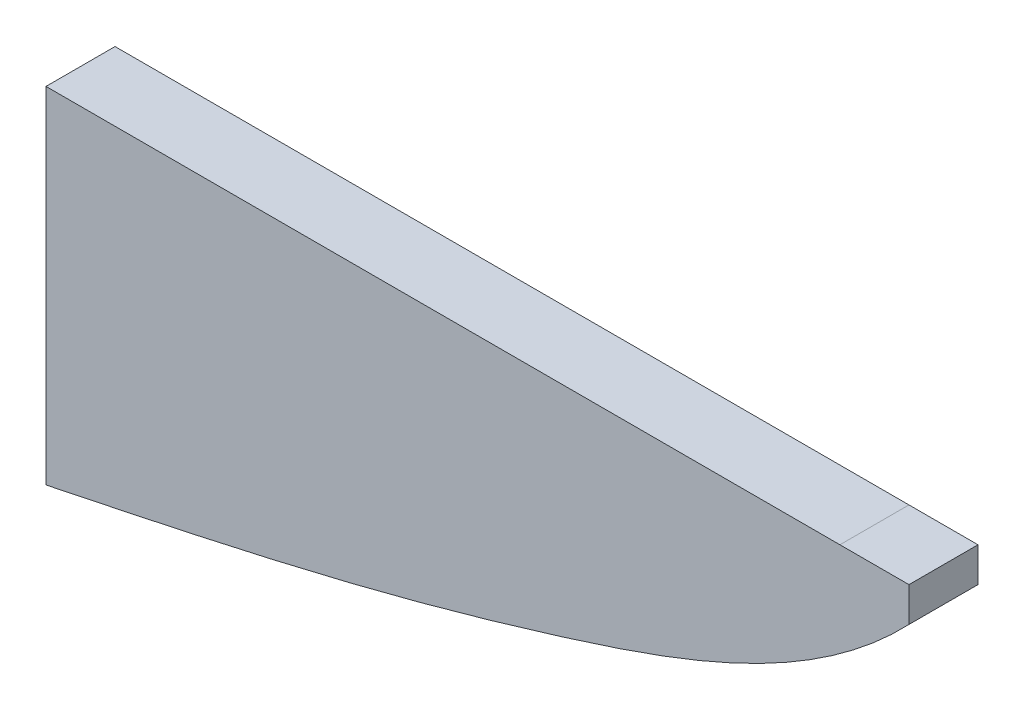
SolidWorks part; units mm, degrees
ref_plane "Ebene vorne" through (0, 0, 0) normal (0, 0, 1) x (1, 0, 0)
ref_plane "Ebene oben" through (0, 0, 0) normal (0, 1, 0) x (1, 0, 0)
ref_plane "Ebene rechts" through (0, 0, 0) normal (1, 0, 0) x (0, 0, -1)
sketch "Skizze1" plane through (0, 0, 0) normal (0, 0, 1) x (1, 0, 0)
  line L0 (0, 0) -> (94.8472, 0) construction
  line L1 (0, -50) -> (0, 50)
  line L2 (0, 50) -> (250, 50)
  line L3 (50, 50) -> (50, -39.4)
  line L4 (100, 50) -> (100, -27.5)
  line L5 (150, 50) -> (150, -13.2)
  line L6 (200, 50) -> (200, 5.3)
  line L7 (250, 50) -> (250, 40)
  spline S0 degree 3 poles (0, -50) (33.4199, -43.0609) (83.9633, -32.5542) (169.944, -7.8832) (222.6154, 11.3744) (250, 40) knots 0 0 0 0 0.381515 0.575066 1 1 1 1
  point P14 (-115.2196, 98.0463)
  dimension "D1" = 100
  dimension "D2" = 50
  dimension "D3" = 250
  dimension "D4" = 50
  dimension "D5" = 50
  dimension "D6" = 50
  dimension "D7" = 50
  dimension "D8" = 89.4
  dimension "D9" = 77.5
  dimension "D10" = 63.2
  dimension "D11" = 44.7
  dimension "D12" = 10
extrude "Aufsatz-Linear austragen1" add sketch "Skizze1" along normal blind 20 contours L1 L2 L7 S0
sketch "Skizze2" plane through (0, 50, 0) normal (0, 1, 0) x (1, 0, 0)
  line L0 (230, -20) -> (230, 0)
  line L1 (0, -20) -> (250, -20) construction
  line L2 (0, 0) -> (250, 0) construction
  line L3 (250, -20) -> (250, 0) construction
  dimension "D1" = 20
